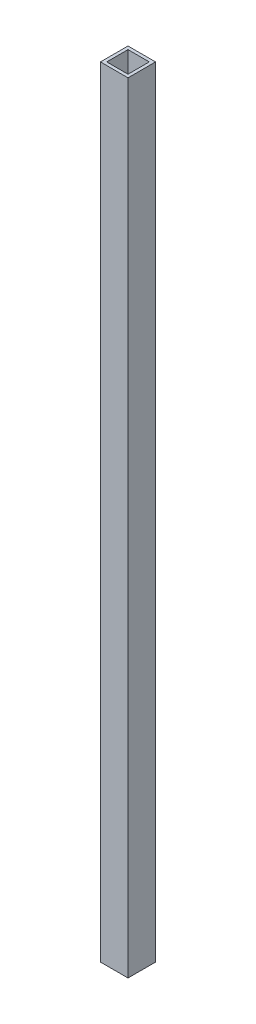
SolidWorks part; units mm, degrees
ref_plane "Front Plane" through (0, 0, 0) normal (0, 0, 1) x (1, 0, 0)
ref_plane "Top Plane" through (0, 0, 0) normal (0, 1, 0) x (1, 0, 0)
ref_plane "Right Plane" through (0, 0, 0) normal (1, 0, 0) x (0, 0, -1)
sketch "Sketch1" plane through (0, 0, 0) normal (0, 1, 0) x (1, 0, 0)
  line L1 (-10.25, -10.25) -> (10.25, -10.25)
  line L2 (-10.25, -10.25) -> (-10.25, 10.25)
  line L3 (-10.25, 10.25) -> (10.25, 10.25)
  line L4 (10.25, -10.25) -> (10.25, 10.25)
  line L5 (-10.25, -10.25) -> (10.25, 10.25) construction
  line L6 (-10.25, 10.25) -> (10.25, -10.25) construction
  line L7 (-13.25, -13.25) -> (13.25, -13.25)
  line L8 (-13.25, -13.25) -> (-13.25, 13.25)
  line L9 (-13.25, 13.25) -> (13.25, 13.25)
  line L10 (13.25, -13.25) -> (13.25, 13.25)
  line L11 (-13.25, -13.25) -> (13.25, 13.25) construction
  line L12 (-13.25, 13.25) -> (13.25, -13.25) construction
  point P0 (0, 0)
  point P6 (0, 0)
  dimension "D1" = 20.5
  dimension "D2" = 20.5
  dimension "D3" = 26.5
extrude "Boss-Extrude1" add sketch "Sketch1" along normal blind 750
hole_wizard "#6 Clearance Hole2" positions "Sketch5" profile "Sketch4" hole size "#6" standard "Ansi Inch"
sketch "Sketch5" plane through (0, 0, -13.25) normal (0, 0, -1) x (-1, 0, 0)
  point P0 (0, 40)
  point P1 (0, 90)
sketch "Sketch4" plane through (0, 40, -13.25) normal (1, 0, 0) x (0, 1, 0)
  line L0 (0, 0) -> (0, 6.1408)
  line L1 (0, 6.1408) -> (1.8986, 5)
  line L2 (1.8986, 5) -> (1.8986, 0)
  line L5 (1.8986, 0) -> (0, 0)
  line L10 (0, 6.1408) -> (-1.8986, 5) construction
  line L11 (0, -6.35) -> (0, 107.95) construction
  dimension "Hole Dia." = 3.7973
  dimension "Hole Depth" = 5
  dimension "Drill Angle" = 118
